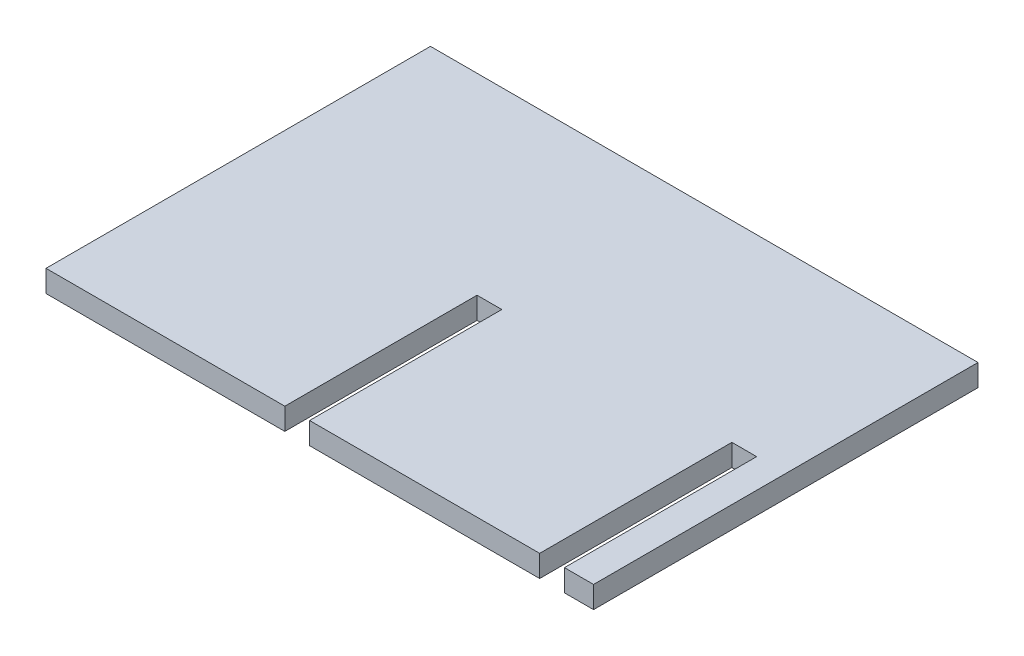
SolidWorks part; units mm, degrees
ref_plane "Alzado" through (0, 0, 0) normal (0, 0, 1) x (1, 0, 0)
ref_plane "Planta" through (0, 0, 0) normal (0, 1, 0) x (1, 0, 0)
ref_plane "Vista lateral" through (0, 0, 0) normal (1, 0, 0) x (0, 0, -1)
sketch "Croquis14" plane through (0, 0, 0) normal (0, 0, 1) x (1, 0, 0)
  line L0 (-34.75, -19.25) -> (-34.75, -20.75)
  line L1 (-35, -19) -> (35, -19) construction
  line L2 (-35, -19) -> (-35, -21) construction
  line L3 (-35, -21) -> (35, -21) construction
  line L4 (35, -19) -> (35, -21) construction
  line L5 (-34.75, -20.75) -> (34.75, -20.75)
  line L6 (34.75, -19.25) -> (34.75, -20.75)
  line L7 (-34.75, -19.25) -> (34.75, -19.25)
  dimension "D1" = 0.25
extrude "Saliente-Extruir8" add sketch "Croquis14" along normal blind 26.4
sketch "Croquis17" plane through (0, -20.75, 0) normal (0, -1, 0) x (1, 0, 0)
  line L0 (-18.35, 13.2) -> (-16.65, 13.2)
  line L3 (-18.35, 26.4) -> (-16.65, 26.4)
  line L9 (-18.35, 13.2) -> (-18.35, 26.4)
  line L10 (34.75, 26.4) -> (-34.75, 26.4) construction
  line L11 (-16.65, 13.2) -> (-16.65, 26.4)
  line L12 (-34.75, 26.4) -> (34.75, 26.4) construction
  line L13 (18.35, 26.4) -> (16.65, 26.4)
  line L14 (18.35, 26.4) -> (18.35, 13.2)
  line L15 (18.35, 13.2) -> (16.65, 13.2)
  line L16 (16.65, 26.4) -> (16.65, 13.2)
  line L17 (34.75, 26.4) -> (34.75, 0) construction
  line L19 (0.85, 26.4) -> (-0.85, 26.4)
  line L20 (0.85, 26.4) -> (0.85, 13.2)
  line L21 (0.85, 13.2) -> (-0.85, 13.2)
  line L22 (-0.85, 26.4) -> (-0.85, 13.2)
  dimension "D1" = 1.7
  dimension "D2" = 13.2
  dimension "D3" = 13.2
  dimension "D4" = 1.7
  dimension "D5" = 16.4
  dimension "D6" = 1.7
  dimension "D7" = 13.2
  dimension "D8" = 15.8
extrude "Cortar-Extruir1" cut sketch "Croquis17" against normal up to surface (1.5 mm away)
sketch "Croquis18" plane through (0, -20.75, 0) normal (0, -1, 0) x (1, 0, 0)
  line L0 (-34.75, 0) -> (34.75, 0) construction
  line L1 (34.75, 26.4) -> (2.85, 26.4)
  line L2 (34.75, 26.4) -> (34.75, 0)
  line L3 (34.75, 0) -> (2.85, 0)
  line L4 (2.85, 26.4) -> (2.85, 0)
  line L5 (0.85, 13.2) -> (0.85, 26.4) construction
  dimension "D1" = 31.9
extrude "Cortar-Extruir2" cut sketch "Croquis18" against normal up to surface (1.5 mm away)
